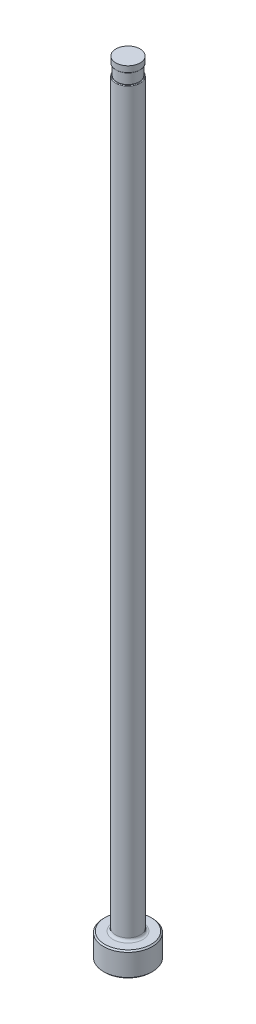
SolidWorks part; units mm, degrees
ref_plane "Front Plane" through (0, 0, 0) normal (0, 0, 1) x (1, 0, 0)
ref_plane "Top Plane" through (0, 0, 0) normal (0, 1, 0) x (1, 0, 0)
ref_plane "Right Plane" through (0, 0, 0) normal (1, 0, 0) x (0, 0, -1)
other "Configuration Table"
sketch "Sketch1" plane through (0, 0, 0) normal (0, 0, 1) x (1, 0, 0)
  line L0 (0, 259.9588) -> (0, -15.1925) construction
  line L1 (0, 0) -> (-4.7625, 0)
  line L2 (-4.7625, 0) -> (-4.7625, 4.7498)
  line L3 (-4.7625, 4.7498) -> (-2.3812, 4.7498)
  line L4 (-2.3812, 4.7498) -> (-2.3812, 152.4)
  line L5 (-2.3812, 152.4) -> (0, 152.4)
  line L6 (0, 152.4) -> (0, 0)
  dimension "L" = 152.4
  dimension "H" = 9.525
  dimension "T" = 4.7498
  dimension "D" = 4.7625
revolve "Revolve1" add sketch "Sketch1" angle 360 about L0
chamfer "Chamfer1" distance 0.254 angle 45 2 edges at (0, 4.7498, 4.7625) (0, 0, 4.7625)
fillet "Fillet1" radius 0.508 1 edges at (0, 4.7498, 2.3812)
sketch "Sketch2" plane through (0, 0, 0) normal (0, 0, 1) x (1, 0, 0)
  line L0 (-2.3812, 152.4) -> (-2.3812, 5.2578) construction
  line L1 (-2.3812, 151.13) -> (-2.178, 151.13)
  line L2 (-2.3812, 151.13) -> (-2.3812, 149.098)
  line L3 (-2.3812, 149.098) -> (-2.178, 149.098)
  line L4 (-2.178, 151.13) -> (-2.178, 149.098)
  line L5 (2.3812, 152.4) -> (-2.3812, 152.4) construction
  line L6 (0, 153.4483) -> (0, 147.3282) construction
  dimension "D1" = 2.032
  dimension "N" = 1.27
  dimension "FD" = 0.2032
  dimension "D3" = 4.3561
revolve "Vent Relief" cut sketch "Sketch2" angle 360 about L6
sketch "Sketch3" plane through (0, 0, 0) normal (0, 0, 1) x (1, 0, 0)
  line L0 (-2.178, 150.114) -> (-2.178, 86.614)
  line L1 (-2.178, 151.13) -> (-2.178, 149.098) construction
  line L2 (-2.3812, 149.098) -> (-2.3812, 5.2578) construction
  line L3 (-2.3812, 85.4964) -> (-2.3812, 150.114)
  line L4 (-2.3812, 150.114) -> (-2.178, 150.114)
  arc A0 (-2.178, 86.614) -> (-2.3812, 85.4964) centre (-5.353, 86.614) cw
  dimension "D1" = 3.175
  dimension "D2" = 63.5
extrude "D-Slot" cut sketch "Sketch3" against normal through all both and the other way through all
sketch "Sketch5" plane through (0, 0, 0) normal (0, 0, 1) x (1, 0, 0)
  line L0 (-2.3812, 151.13) -> (2.3812, 151.13) construction
  line L1 (-2.3812, 152.4) -> (-2.3622, 152.4)
  line L2 (-2.3812, 152.4) -> (-2.3812, 151.13)
  line L3 (-2.3812, 151.13) -> (-2.3622, 151.13)
  line L4 (-2.3622, 152.4) -> (-2.3622, 151.13)
  line L5 (0, 152.6877) -> (0, 150.5771) construction
  dimension "VP" = 0.019
revolve "Vent Diameter" cut sketch "Sketch5" angle 360 about L5
fillet "Fillet2" radius 0.127 2 edges at (2.3812, 149.098, 0) (0, 151.13, 2.3622)
sketch "Pocket Sketch" plane through (0, 0, 0) normal (0, 0, 1) x (1, 0, 0)
  line L0 (-5.1594, 0) -> (-5.1594, 4.7752)
  line L1 (-5.1594, 4.7752) -> (-3.3417, 4.7752)
  line L2 (-2.5797, 5.5372) -> (-2.5797, 22.225)
  line L3 (-2.5797, 22.225) -> (0, 22.225)
  line L4 (0, 22.225) -> (0, 0)
  line L5 (0, 0) -> (-5.1594, 0)
  line L6 (0, 12.6104) -> (0, -2.4989) construction
  line L7 (-4.7625, 4.4958) -> (-4.7625, 0.254) construction
  line L8 (4.5085, 4.7498) -> (-4.5085, 4.7498) construction
  line L9 (-2.3812, 85.4964) -> (-2.3812, 5.2578) construction
  line L10 (-3.3417, 4.7752) -> (-2.5797, 5.5372)
  point P3 (-2.5797, 4.7752)
  dimension "D1" = 10.3187
  dimension "D2" = 0.3969
  dimension "D3" = 0.0254
  dimension "D4" = 0.1984
  dimension "D5" = 5.1594
  dimension "D6" = 22.225
